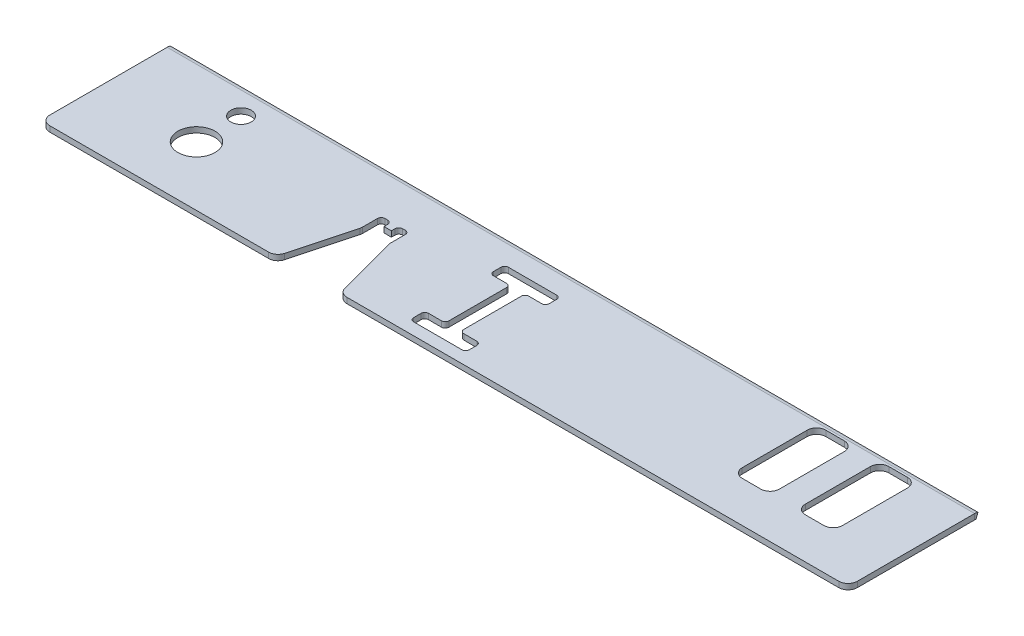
SolidWorks part; units mm, degrees
ref_plane "Plan1" through (0, 0, 0) normal (0, 0, 1) x (1, 0, 0)
ref_plane "Plan2" through (0, 0, 0) normal (0, 1, 0) x (1, 0, 0)
ref_plane "Plan3" through (0, 0, 0) normal (1, 0, 0) x (0, 0, -1)
sketch "Esquisse1" plane through (0, 0, 0) normal (0, 0, 1) x (1, 0, 0)
  line L0 (0, 157.1) -> (435, 157.1) construction
  line L1 (165.0744, 228.2) -> (180, 228.2)
  line L2 (0, 223.2) -> (0, 10)
  line L3 (10, 0) -> (320.5, 0)
  line L4 (52, 196.2) -> (52, 172.2) construction
  line L5 (136.5, 191.2) -> (136.5, 183.2)
  line L6 (138.5, 181.2) -> (140, 181.2)
  line L7 (5, 228.2) -> (122.9256, 228.2)
  line L8 (151.5, 191.2) -> (151.5, 183.2)
  line L9 (374.5, 10) -> (10, 10) construction
  line L10 (292.29, -14) -> (415.5, -14) construction
  line L11 (378, 44.3) -> (378, -33) construction
  line L12 (151.6704, 192.4941) -> (160.2447, 224.4941)
  line L13 (136.3296, 192.4941) -> (127.7553, 224.4941)
  line L14 (435, 223.2) -> (435, 14.3925)
  line L15 (412.4886, -33) -> (340.5, -33)
  line L16 (330.5, -10) -> (330.5, -23)
  line L17 (434.4832, 11.2195) -> (421.9719, -26.173)
  line L19 (148, 181.2) -> (149.5, 181.2)
  line L20 (180, 228.2) -> (430, 228.2)
  line L22 (378, 181) -> (378, 157.1) construction
  line L23 (144, 191.2) -> (144, 157.1) construction
  line L24 (156.5, 191.2) -> (131.5, 191.2) construction
  line L25 (204.7, 217.7) -> (240.1, 217.7) construction
  line L26 (213.5, 213.7) -> (220.5, 213.7)
  line L27 (203.5, 211.7) -> (203.5, 180.7)
  line L28 (222.5, 176.7) -> (222.5, 172.7)
  line L29 (211.5, 211.7) -> (211.5, 180.7)
  line L30 (194.5, 213.7) -> (201.5, 213.7)
  line L31 (146, 183.2) -> (146, 185.2)
  line L32 (146, 185.2) -> (142, 185.2)
  line L33 (390, 206.2) -> (400, 206.2)
  line L34 (385, 201.2) -> (385, 166.2)
  line L35 (390, 161.2) -> (400, 161.2)
  line L36 (405, 201.2) -> (405, 166.2)
  line L37 (356, 206.2) -> (366, 206.2)
  line L38 (351, 201.2) -> (351, 166.2)
  line L39 (356, 161.2) -> (366, 161.2)
  line L40 (371, 201.2) -> (371, 166.2)
  line L41 (142, 183.2) -> (142, 185.2)
  line L42 (192.5, 215.7) -> (192.5, 219.7)
  line L43 (194.5, 170.7) -> (220.5, 170.7)
  line L44 (194.5, 221.7) -> (220.5, 221.7)
  line L45 (222.5, 215.7) -> (222.5, 219.7)
  line L46 (192.5, 176.7) -> (192.5, 172.7)
  line L47 (194.5, 178.7) -> (201.5, 178.7)
  line L48 (213.5, 178.7) -> (220.5, 178.7)
  line L51 (212.9, 196.2) -> (229.6, 196.2) construction
  line L54 (207.5, 196.2) -> (207.5, 219.5295) construction
  arc A0 (320.5, 0) -> (330.5, -10) centre (320.5, -10) cw
  circle A1 centre (52, 172.2) radius 5.5
  circle A2 centre (52, 196.2) radius 10
  circle A3 centre (10, 10) radius 5.5
  circle A5 centre (340.5, -14) radius 4.5
  circle A6 centre (415.5, -14) radius 4.5
  arc A7 (434.4832, 11.2195) -> (435, 14.3925) centre (425, 14.3925) ccw
  arc A8 (412.4886, -33) -> (421.9719, -26.173) centre (412.4886, -23) ccw
  arc A10 (10, 0) -> (0, 10) centre (10, 10) cw
  arc A11 (340.5, -33) -> (330.5, -23) centre (340.5, -23) cw
  arc A12 (165.0744, 228.2) -> (160.2447, 224.4941) centre (165.0744, 223.2) ccw
  arc A13 (122.9256, 228.2) -> (127.7553, 224.4941) centre (122.9256, 223.2) cw
  arc A14 (0, 223.2) -> (5, 228.2) centre (5, 223.2) cw
  arc A15 (430, 228.2) -> (435, 223.2) centre (430, 223.2) cw
  arc A16 (151.6704, 192.4941) -> (151.5, 191.2) centre (156.5, 191.2) ccw
  arc A17 (136.3296, 192.4941) -> (136.5, 191.2) centre (131.5, 191.2) cw
  arc A18 (138.5, 181.2) -> (136.5, 183.2) centre (138.5, 183.2) cw
  circle A19 centre (422.5, 144) radius 4.5
  arc A20 (149.5, 181.2) -> (151.5, 183.2) centre (149.5, 183.2) ccw
  arc A21 (148, 181.2) -> (146, 183.2) centre (148, 183.2) cw
  arc A22 (351, 201.2) -> (356, 206.2) centre (356, 201.2) cw
  arc A23 (366, 206.2) -> (371, 201.2) centre (366, 201.2) cw
  arc A24 (211.5, 211.7) -> (213.5, 213.7) centre (213.5, 211.7) cw
  arc A25 (201.5, 213.7) -> (203.5, 211.7) centre (201.5, 211.7) cw
  arc A26 (192.5, 215.7) -> (194.5, 213.7) centre (194.5, 215.7) ccw
  arc A27 (194.5, 221.7) -> (192.5, 219.7) centre (194.5, 219.7) ccw
  arc A28 (356, 161.2) -> (351, 166.2) centre (356, 166.2) cw
  arc A29 (371, 166.2) -> (366, 161.2) centre (366, 166.2) cw
  arc A30 (385, 201.2) -> (390, 206.2) centre (390, 201.2) cw
  arc A31 (390, 161.2) -> (385, 166.2) centre (390, 166.2) cw
  arc A32 (405, 166.2) -> (400, 161.2) centre (400, 166.2) cw
  arc A33 (400, 206.2) -> (405, 201.2) centre (400, 201.2) cw
  arc A34 (140, 181.2) -> (142, 183.2) centre (140, 183.2) ccw
  circle A35 centre (320.5, 10) radius 5.5
  arc A36 (222.5, 219.7) -> (220.5, 221.7) centre (220.5, 219.7) ccw
  arc A37 (220.5, 213.7) -> (222.5, 215.7) centre (220.5, 215.7) ccw
  arc A38 (220.5, 178.7) -> (222.5, 176.7) centre (220.5, 176.7) cw
  arc A39 (222.5, 172.7) -> (220.5, 170.7) centre (220.5, 172.7) cw
  arc A40 (194.5, 170.7) -> (192.5, 172.7) centre (194.5, 172.7) cw
  arc A41 (192.5, 176.7) -> (194.5, 178.7) centre (194.5, 176.7) cw
  arc A42 (201.5, 178.7) -> (203.5, 180.7) centre (201.5, 180.7) ccw
  arc A43 (211.5, 180.7) -> (213.5, 178.7) centre (213.5, 180.7) ccw
  point P35 (435, -33)
  point P42 (0, 0)
  point P45 (330.5, -33)
  point P52 (0, 228.2)
  point P55 (435, 228.2)
  point P60 (151.5, 191.8583)
  point P63 (136.5, 191.8583)
  point P76 (136.5, 181.2)
  point P79 (151.5, 181.2)
  point P100 (203.5, 196.2)
  point P154 (211.5, 196.2)
  dimension "D5" = 9
  dimension "D8" = 11
  dimension "D14" = 20
  dimension "D15" = 134
  dimension "D23" = 71.5
  dimension "D25" = 10
  dimension "D28" = 4
  dimension "D29" = 10
  dimension "D30" = 15
  dimension "D31" = 5
  dimension "D33" = 4
  dimension "D34" = 5
  dimension "D35" = 5
  dimension "D36" = 2
  dimension "D37" = 8
  dimension "D6" = 10
  dimension "D39" = 14
  dimension "D43" = 8
  dimension "D7" = 11
  dimension "D46" = 10
  dimension "D45" = 21.5
  dimension "D52" = 5
  dimension "D17" = 12.5
  dimension "D48" = 32
  dimension "D54" = 9
  dimension "D53" = 2
  dimension "D1" = 435
  dimension "D2" = 71.1
  dimension "D3" = 32
  dimension "D4" = 104.5
  dimension "D9" = 52
  dimension "D10" = 47
  dimension "D11" = 15
  dimension "D12" = 144
  dimension "D13" = 56
  dimension "D16" = 10
  dimension "D18" = 10
  dimension "D19" = 19
  dimension "D21" = 57
  dimension "D22" = 75
  dimension "D24" = 261.2
  dimension "D32" = 10
  dimension "D38" = 22
  dimension "D40" = 20
  dimension "D41" = 57
  dimension "D42" = 30
  dimension "D44" = 207.5
  dimension "D47" = 147.1
  dimension "D49" = 20
  dimension "D50" = 30
  dimension "D51" = 45
extrude "Base-Extrusion" add sketch "Esquisse1" along normal blind 3
sheet metal parameters "Tôlerie 2" parameters "D1"=3, "Epaisseur"=3
flatten bends "Dépliage 2" parameters "D1"=3
sketch "Esquisse-Angle2" plane through (0, 0, 3) normal (0, 0, 1) x (1, 0, 0)
process bends "Pliage 2" parameters "D1"=1.8
sketch "Esquisse-Plate2" plane through (0, 0, 3) normal (0, 0, 1) x (1, 0, 0)
  line L0 (-30, 157.1) -> (471.5974, 157.1)
  line L1 (430, 228.2) -> (165.0744, 228.2) construction
  line L2 (430, 228.2) -> (165.0744, 228.2) construction
  circle A1 centre (52, 172.2) radius 5.5 construction
  point P2 (217.5, 70.1)
  dimension "D2" = 15.1
  dimension "D1" = 71.1
bend "Pli défini à plat1" bend radius 1.8 bend angle 90 parameters "D5"=1
sketch "Esquisse2" plane through (0, 0, 3) normal (0, 0, 1) x (1, 0, 0)
  line L0 (0, 174.5883) -> (435, 174.5883)
  line L8 (435, 14.3925) -> (435, 154.2)
  line L9 (435, 154.2) -> (0, 154.2)
  line L10 (0, 154.2) -> (0, 10)
  line L11 (10, 0) -> (320.5, 0)
  line L12 (330.5, -10) -> (330.5, -23)
  line L13 (340.5, -33) -> (412.4886, -33)
  line L14 (421.9719, -26.173) -> (434.4832, 11.2195)
  line L15 (435, 14.3925) -> (435, 174.5883)
  line L17 (0, 174.5883) -> (0, 10)
  line L18 (10, 0) -> (320.5, 0)
  line L19 (330.5, -10) -> (330.5, -23)
  line L20 (340.5, -33) -> (412.4886, -33)
  line L21 (421.9719, -26.173) -> (434.4832, 11.2195)
  arc A5 (0, 10) -> (10, 0) centre (10, 10) ccw
  arc A6 (330.5, -10) -> (320.5, 0) centre (320.5, -10) ccw
  arc A7 (330.5, -23) -> (340.5, -33) centre (340.5, -23) ccw
  arc A8 (412.4886, -33) -> (421.9719, -26.173) centre (412.4886, -23) ccw
  arc A9 (434.4832, 11.2195) -> (435, 14.3925) centre (425, 14.3925) ccw
  arc A10 (0, 10) -> (10, 0) centre (10, 10) ccw
  arc A11 (330.5, -10) -> (320.5, 0) centre (320.5, -10) ccw
  arc A12 (330.5, -23) -> (340.5, -33) centre (340.5, -23) ccw
  arc A13 (412.4886, -33) -> (421.9719, -26.173) centre (412.4886, -23) ccw
  arc A14 (434.4832, 11.2195) -> (435, 14.3925) centre (425, 14.3925) ccw
  dimension "D1" = 0
extrude "Enlèv. mat.-Extru.1" cut sketch "Esquisse2" against normal through all
